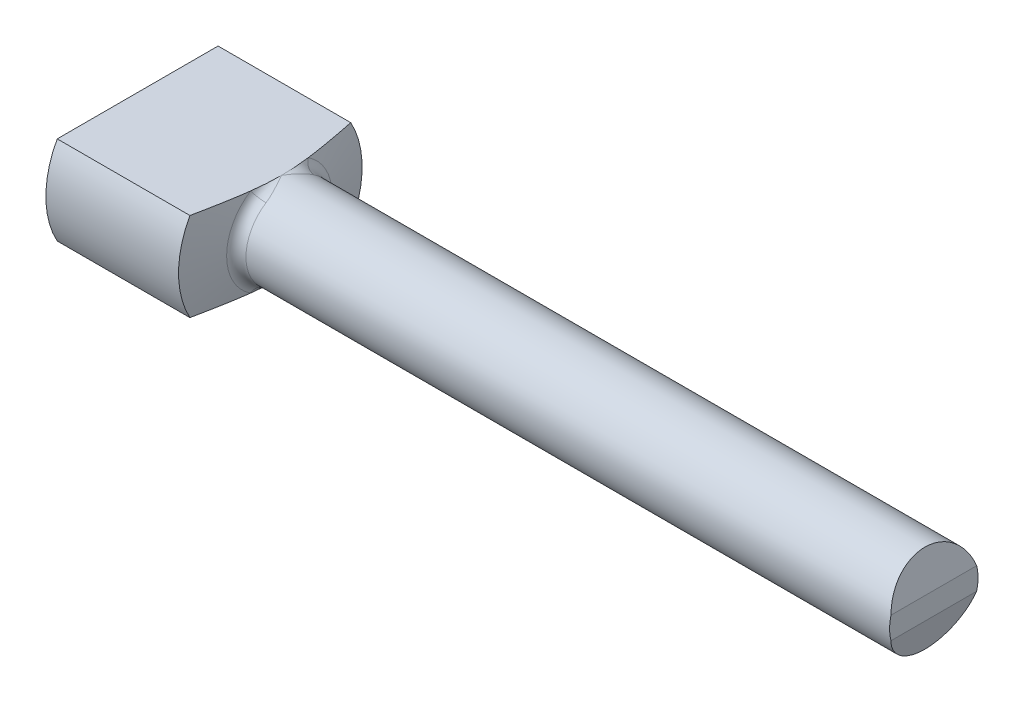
SolidWorks part; units mm, degrees
ref_plane "Přední rovina" through (0, 0, 0) normal (0, 0, 1) x (1, 0, 0)
ref_plane "Horní rovina" through (0, 0, 0) normal (0, 1, 0) x (1, 0, 0)
ref_plane "Pravá rovina" through (0, 0, 0) normal (1, 0, 0) x (0, 0, -1)
sketch "Skica1" plane through (0, 0, 0) normal (0, 0, 1) x (1, 0, 0)
  line L0 (0, 0) -> (0, 4.15)
  line L1 (0, 4.15) -> (6, 4.15)
  line L2 (6, 4.15) -> (6.5, 2)
  line L3 (6.5, 2) -> (36, 2)
  line L4 (36, 2) -> (36, 0)
  line L5 (36, 0) -> (0, 0)
  dimension "D1" = 2
  dimension "D2" = 4.15
  dimension "D3" = 36
  dimension "D4" = 6
  dimension "D5" = 6.5
revolve "Rotovat1" add sketch "Skica1" angle 360 about L5
sketch "Skica2" plane through (0, 0, 0) normal (-1, 0, 0) x (0, 0, 1)
  line L1 (-4.5, 2) -> (4.5, 2)
  line L2 (-4.5, 2) -> (-4.5, -2)
  line L3 (-4.5, -2) -> (4.5, -2)
  line L4 (4.5, 2) -> (4.5, -2)
  line L5 (-4.5, 2) -> (4.5, -2) construction
  line L6 (-4.5, -2) -> (4.5, 2) construction
  point P0 (0, 0)
  dimension "D1" = 4
  dimension "D2" = 9
extrude "Odebrat vysunutím1" cut sketch "Skica2" against normal blind 10 flip side to cut
fillet "Zaoblit1" radius 0.5 2 edges at (6.5, 0, -2) (6.5, 0, 2)
sketch "Skica3" plane through (0, 0, 0) normal (0, 0, 1) x (1, 0, 0)
  line L0 (36, 0.5) -> (36, 2)
  line L1 (36, -2) -> (36, 2) construction
  line L2 (36, 2) -> (35.6, 2)
  line L3 (36, 2) -> (6.5, 2) construction
  line L4 (35.6, 2) -> (36, 0.5)
  line L5 (36, 0) -> (37.6378, 0) construction
  line L6 (35.6, -2) -> (36, -0.5)
  line L7 (36, -2) -> (35.6, -2)
  line L8 (36, -0.5) -> (36, -2)
  dimension "D1" = 1
  dimension "D2" = 0.4
extrude "Odebrat vysunutím2" cut sketch "Skica3" against normal through all and the other way through all
